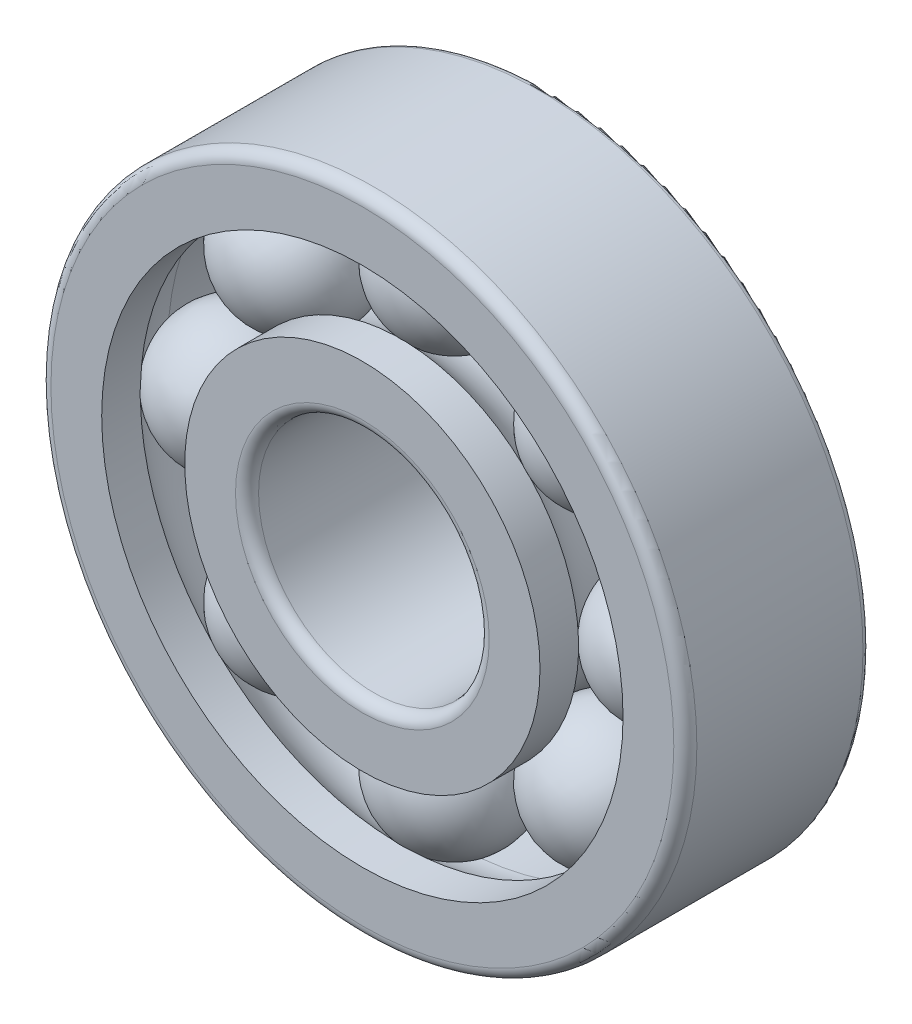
SolidWorks part; units mm, degrees
ref_plane "Front Plane" through (0, 0, 0) normal (0, 0, 1) x (1, 0, 0)
ref_plane "Top Plane" through (0, 0, 0) normal (0, 1, 0) x (1, 0, 0)
ref_plane "Right Plane" through (0, 0, 0) normal (1, 0, 0) x (0, 0, -1)
other "Configuration Table"
sketch "BaseSke" plane through (0, 0, 0) normal (1, 0, 0) x (0, 0, -1)
  line L0 (-47.2296, 0) -> (24.6132, 0) construction
  line L1 (-47.2296, 9.5) -> (24.6132, 9.5) construction
  line L2 (0, 129.5214) -> (0, -86.3012) construction
  line L3 (0, 12.45) -> (0, 6.55)
  line L4 (-4, 14) -> (4, 14) construction
  line L5 (-4, 5) -> (4, 5) construction
  arc A0 (0, 12.45) -> (0, 6.55) centre (0, 9.5) ccw
revolve "Ball" add sketch "BaseSke" angle 360 about L3
sketch "OuterRaceSke" plane through (0, 0, 0) normal (1, 0, 0) x (0, 0, -1)
  line L0 (0, 0) -> (0, 87.5396) construction
  line L1 (-4, 14) -> (4, 14)
  line L2 (-4, 14) -> (-4, 11.3)
  line L3 (-4, 11.3) -> (-2.3246, 11.3)
  line L4 (4, 14) -> (4, 12.44)
  line L5 (-50.3916, 0) -> (55.2197, 0) construction
  line L6 (-47.2296, 9.5) -> (24.6132, 9.5) construction
  line L7 (0, 12.44) -> (4, 12.44)
  arc A0 (0, 12.44) -> (-2.3246, 11.3) centre (0, 9.5) ccw
revolve "OuterRace" add sketch "OuterRaceSke" angle 360 about L5
sketch "InnerRaceSke" plane through (0, 0, 0) normal (1, 0, 0) x (0, 0, -1)
  line L0 (-70.8626, 0) -> (113.5527, 0) construction
  line L1 (0, 58.441) -> (0, -70.8113) construction
  line L2 (-4, 5) -> (4, 5)
  line L3 (-4, 5) -> (-4, 7.7)
  line L4 (-4, 7.7) -> (-2.3246, 7.7)
  line L5 (4, 5) -> (4, 7.7)
  line L6 (0, 129.5214) -> (0, -86.3012) construction
  line L7 (2.3246, 7.7) -> (4, 7.7)
  line L8 (-4, 14) -> (-4, 11.3) construction
  arc A0 (-2.3246, 7.7) -> (2.3246, 7.7) centre (0, 9.5) ccw
  arc A1 (0, 12.45) -> (0, 6.55) centre (0, 9.5) ccw construction
  arc A2 (0, 12.44) -> (-2.3246, 11.3) centre (0, 9.5) ccw construction
revolve "InnerRace" add sketch "InnerRaceSke" angle 360 about L0
fillet "Fillet1" radius 0.5 3 edges at (5, 0, -4) (5, 0, 4) (14, 0, 4)
fillet "Fillet2" radius 0.3 1 edges at (14, 0, -4)
pattern_circular "CirPatternBall" count 8 over 360 about axis through (0, 0, 0) along (0, 0, 1) of "Ball"
sketch "SimplifiedSke" plane through (0, 0, 0) normal (1, 0, 0) x (0, 0, -1)
  line L0 (37.5911, 0) -> (-37.5911, 0) construction
  circle A0 centre (0, 9.5) radius 2.95
  arc A1 (0, 12.45) -> (0, 6.55) centre (0, 9.5) ccw construction
revolve "Simplified" [suppressed] add sketch "SimplifiedSke" angle 360 about L0
equation "\"D1@BaseSke\" =  (\"Bearing_Outside_Diameter@BaseSke\"  +  \"Bearing_Inside_Diameter@BaseSke\"  )  / 4"
equation "\"D2@OuterRaceSke\" = \"Ball_Outer_Diameter@BaseSke\"-0.02"
equation "\"D1@CirPatternBall\" =  int(  pi  * ( \"Bearing_Outside_Diameter@BaseSke\" + \"Bearing_Inside_Diameter@BaseSke\" )  / 2  / \"Bearing_Thickness@BaseSke\"*1.25) -1"
